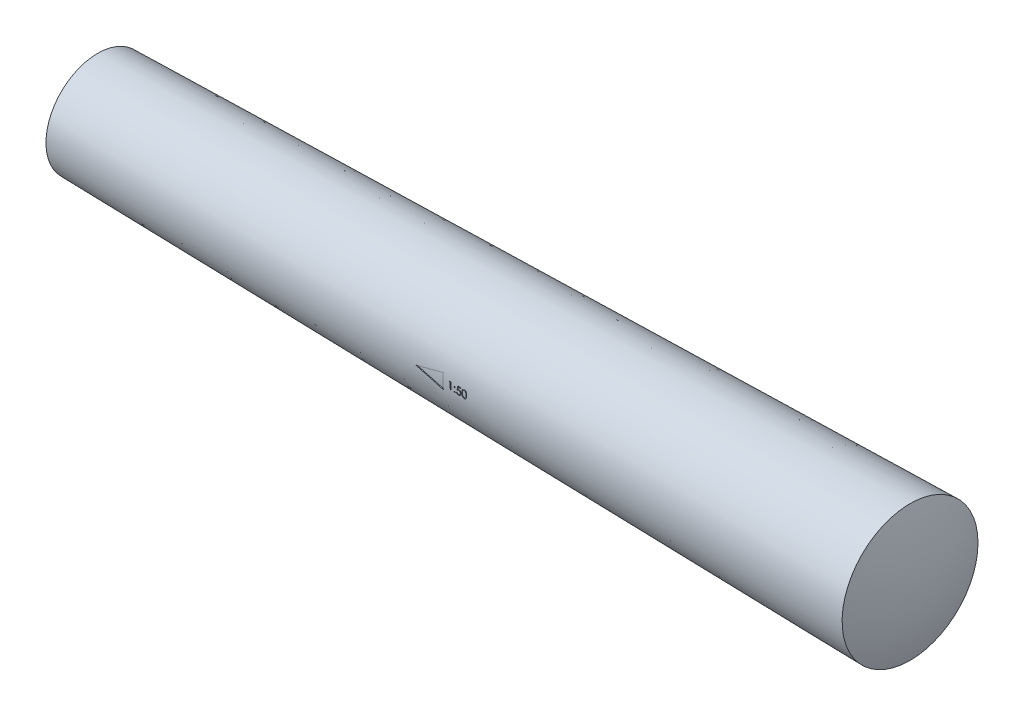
SolidWorks part; units mm, degrees
ref_plane "Front Plane" through (0, 0, 0) normal (0, 0, 1) x (1, 0, 0)
ref_plane "Top Plane" through (0, 0, 0) normal (0, 1, 0) x (1, 0, 0)
ref_plane "Right Plane" through (0, 0, 0) normal (1, 0, 0) x (0, 0, -1)
sketch "Sketch1" plane through (0, 0, 0) normal (1, 0, 0) x (0, 0, -1)
  circle A0 centre (0, 0) radius 7
  dimension "D1" = 14
extrude "Extrude1" add sketch "Sketch1" along normal mid plane 110
draft "Draft1" type of draft neutral plane draft angle 1.146 faces to draft 1 parameters "D1"=1.146
sketch "Sketch2" plane through (0, 0, 0) normal (0, 0, 1) x (1, 0, 0)
  line L0 (-55, 0) -> (-55, 7)
  line L1 (-55, 7) -> (-55, -7) construction
  line L2 (-55, 0) -> (-56.6, 0)
  line L3 (-56.6, 0) -> (-56.6, -8.1) construction
  line L4 (55, 0) -> (55, 9.2001)
  line L5 (55, -9.2001) -> (55, 9.2001) construction
  line L6 (55, 0) -> (56.6, 0)
  line L7 (56.6, 0) -> (56.6, -8.1) construction
  line L8 (-55, -7) -> (55, -9.2001) construction
  arc A0 (-56.6, 0) -> (-55, 7) centre (-40.4875, 0) cw
  arc A1 (56.6, 0) -> (55, 9.2001) centre (29.3496, 0) ccw
  point P14 (0, -8.1)
revolve "Revolve1" add sketch "Sketch2" angle 360 about L2
sketch "Sketch5" plane through (0, 0, 0) normal (0, 0, 1) x (1, 0, 0)
  line L0 (0, 8.1) -> (0, -8.1) construction
  line L1 (55, 9.2001) -> (-55, 7) construction
  line L2 (-55, -7) -> (55, -9.2001) construction
ref_plane "Plane2" through (0, 0, 0) normal (-0.02, 0, 0.9998) x (0.9998, 0, 0.02)
sketch "Sketch6" plane through (0, 0, 0) normal (-0.02, 0, 0.9998) x (0.9998, 0, 0.02)
  line L0 (0, 0) -> (0, 1)
  line L1 (0, 8.1) -> (0, -8.1) construction
  line L2 (0, 1) -> (-3.7321, 0)
  line L3 (-3.7321, 0) -> (0, -1)
  line L4 (0, -1) -> (0, 0)
  line L5 (0, -0.5) -> (4, -0.5) construction
  text T0 "1:50" font "Century Gothic" height 1
  dimension "D1" = 2
  dimension "D2" = 30
  dimension "D3" = 4
wrap "Wrap2" sketch "Sketch6" wrap type deboss source sketch "Sketch6" thickness 0.1 parameters "D1"=0.1
equation "\"D2@Sketch2\" = \"D1@Sketch2\""
